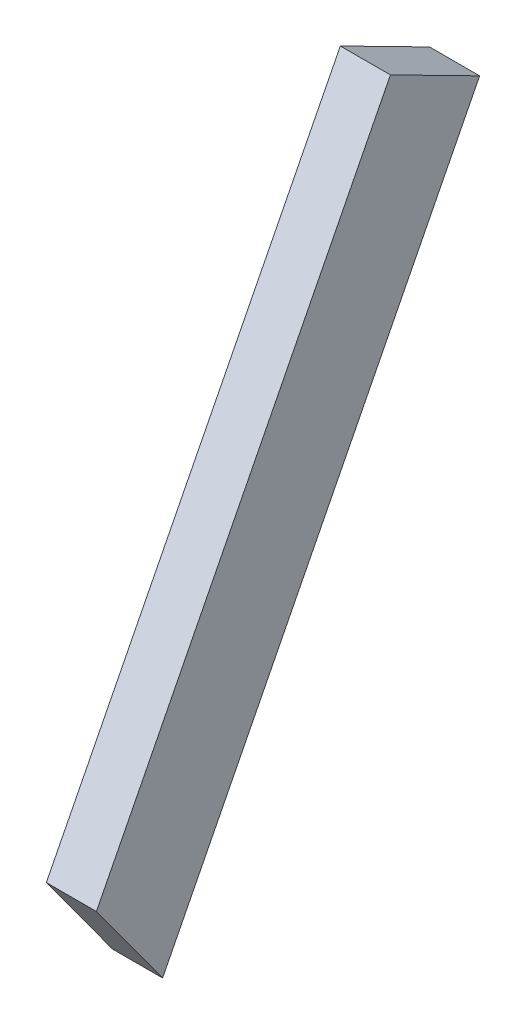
SolidWorks part; units mm, degrees
ref_plane "Face" through (0, 0, 0) normal (0, 0, 1) x (1, 0, 0)
ref_plane "Dessus" through (0, 0, 0) normal (0, 1, 0) x (1, 0, 0)
ref_plane "Droite" through (0, 0, 0) normal (1, 0, 0) x (0, 0, -1)
sketch "Esquisse1" plane through (0, 0, 0) normal (-1, 0, 0) x (0, 0, 1)
  line L0 (-38.2105, 70.4172) -> (-29.2989, 74.954)
  line L1 (-6.5505, 8.2272) -> (30.3467, 8.2272) construction
  line L2 (-6.5505, 8.2272) -> (-38.2105, 70.4172)
  line L3 (-6.5505, 8.2272) -> (0.0595, 17.2852)
  line L4 (0.0595, 17.2852) -> (-29.2989, 74.954)
  dimension "D1" = 10
  dimension "D2" = 62.19
  dimension "D3" = 53.88
  dimension "D4" = 116.98
extrude "Extrusion1" add sketch "Esquisse1" along normal blind 5
